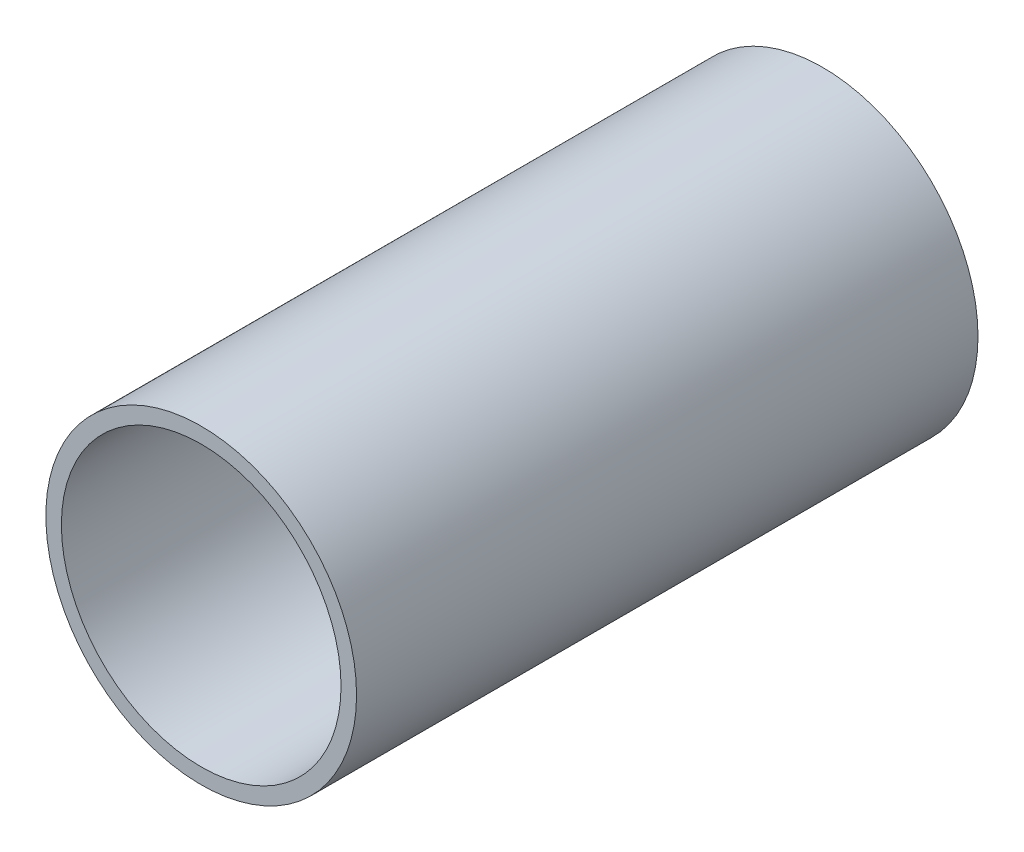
SolidWorks part; units mm, degrees
ref_plane "Plan de face" through (0, 0, 0) normal (0, 0, 1) x (1, 0, 0)
ref_plane "Plan de dessus" through (0, 0, 0) normal (0, 1, 0) x (1, 0, 0)
ref_plane "Plan de droite" through (0, 0, 0) normal (1, 0, 0) x (0, 0, -1)
sketch "Esquisse1" plane through (0, 0, 0) normal (0, 0, 1) x (1, 0, 0)
  line L0 (-115189.1047, 3666.7878) -> (-113935.9526, 13582.9178) construction
  circle A0 centre (0, 0) radius 250
  circle A1 centre (0, 0) radius 225
  dimension "D1" = 500
  dimension "D2" = 450
extrude "Boss.-Extru.1" add sketch "Esquisse1" along normal blind 1000
